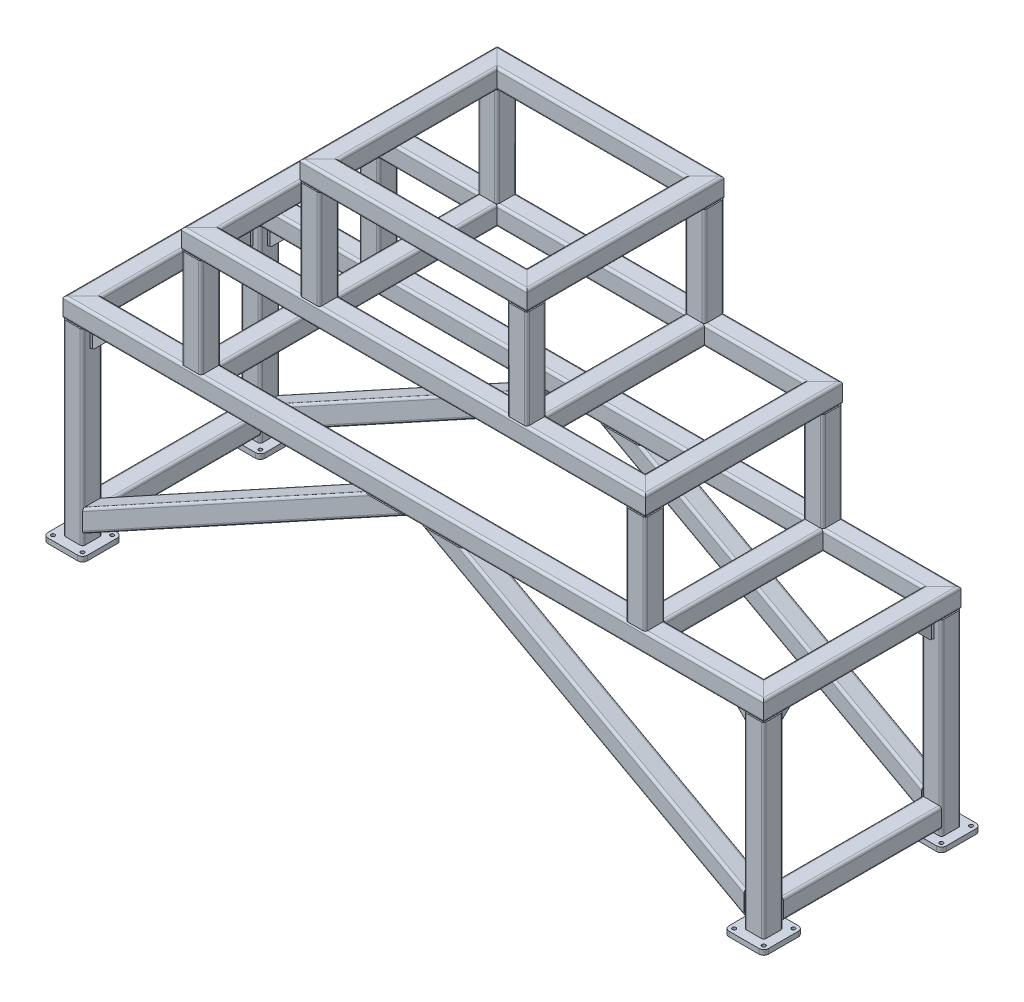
SolidWorks part; units mm, degrees
other "DetailItem1"
other "DetailItem2"
other "DetailItem3"
other "DetailItem4"
other "DetailItem5"
other "DetailItem6"
other "DetailItem7"
other "DetailItem8"
ref_plane "Front Plane" through (0, 0, 0) normal (0, 0, 1) x (1, 0, 0)
ref_plane "Top Plane" through (0, 0, 0) normal (0, 1, 0) x (1, 0, 0)
ref_plane "Right Plane" through (0, 0, 0) normal (1, 0, 0) x (0, 0, -1)
sketch3d "3DSketch1"
  line L0 (533.4, 0, 457.2) -> (533.4, -609.6, 457.2)
  line L1 (-533.4, 0, -457.2) -> (533.4, 0, -457.2)
  line L2 (-533.4, 0, -457.2) -> (-533.4, 0, 457.2)
  line L3 (-533.4, 0, 457.2) -> (533.4, 0, 457.2)
  line L4 (533.4, 0, -457.2) -> (533.4, 0, 457.2)
  line L5 (-533.4, 0, -457.2) -> (533.4, 0, 457.2) construction
  line L6 (-533.4, 0, 457.2) -> (533.4, 0, -457.2) construction
  line L7 (533.4, 0, -457.2) -> (533.4, -609.6, -457.2)
  line L8 (-533.4, 0, -457.2) -> (-533.4, -609.6, -457.2)
  line L9 (-533.4, 0, 457.2) -> (-533.4, -609.6, 457.2)
  line L10 (-533.4, -609.6, 457.2) -> (-533.4, -609.6, -457.2)
  line L11 (533.4, -609.6, 457.2) -> (533.4, -609.6, -457.2)
  line L12 (1752.6, -2150.4402, 457.2) -> (1752.6, -2150.4402, -457.2)
  line L13 (-1752.6, -2150.4402, -457.2) -> (-1752.6, -2150.4402, 457.2)
  line L16 (1143, -609.6, 457.2) -> (-1143, -609.6, 457.2)
  line L17 (1143, -609.6, -457.2) -> (-1143, -609.6, -457.2)
  line L18 (1143, -609.6, 457.2) -> (1143, -609.6, -457.2)
  line L19 (-1143, -609.6, 457.2) -> (-1143, -609.6, -457.2)
  line L20 (1143, -609.6, 457.2) -> (1143, -1219.2, 457.2)
  line L21 (1143, -609.6, -457.2) -> (1143, -1219.2, -457.2)
  line L22 (-1143, -609.6, 457.2) -> (-1143, -1219.2, 457.2)
  line L23 (-1143, -609.6, -457.2) -> (-1143, -1219.2, -457.2)
  line L24 (-1143, -1219.2, 457.2) -> (-1143, -1219.2, -457.2)
  line L25 (1143, -1219.2, 457.2) -> (1143, -1219.2, -457.2)
  line L26 (1752.6, -1219.2, 457.2) -> (-1752.6, -1219.2, 457.2)
  line L27 (1752.6, -1219.2, -457.2) -> (-1752.6, -1219.2, -457.2)
  line L32 (-1752.6, -1219.2, 457.2) -> (-1752.6, -1219.2, -457.2)
  line L33 (1752.6, -1219.2, 457.2) -> (1752.6, -1219.2, -457.2)
  line L34 (-1752.6, -1219.2, 457.2) -> (-1752.6, -2235.2, 457.2)
  line L35 (-1752.6, -1219.2, -457.2) -> (-1752.6, -2235.2, -457.2)
  line L36 (1752.6, -1219.2, 457.2) -> (1752.6, -2235.2, 457.2)
  line L37 (1752.6, -1219.2, -457.2) -> (1752.6, -2235.2, -457.2)
  line L46 (-1752.6, -2150.4402, 457.2) -> (-53.975, -1219.2, 457.2)
  line L47 (53.975, -1219.2, 457.2) -> (1752.6, -2150.4402, 457.2)
  line L48 (1752.6, -2150.4402, -457.2) -> (53.975, -1219.2, -457.2)
  line L49 (-53.975, -1219.2, -457.2) -> (-1752.6, -2150.4402, -457.2)
  point P0 (0, 0, 0)
  dimension "D1" = 1066.8
  dimension "D2" = 914.4
  dimension "D3" = 609.6
  dimension "D4" = 609.6
  dimension "D5" = 609.6
  dimension "D8" = 53.975
  dimension "D6" = 609.6
  dimension "D7" = 1016
  dimension "D9" = 53.975
  dimension "D10" = 53.975
  dimension "D11" = 53.975
  dimension "D12" = 914.4
  dimension "D13" = 914.4
  dimension "D14" = 3505.2
  dimension "D15" = 1752.6
  dimension "D16" = 84.7598
  dimension "D17" = 84.7598
  dimension "D18" = 84.7598
  dimension "D19" = 84.7598
other "Structural Member1"
ref_plane "Plane8" through (-533.4, 0, 457.2) normal (1, 0, 0) x (0, 0, -1)
sketch "Sketch1" plane through (-533.4, 0, 457.2) normal (1, 0, 0) x (0, 0, -1)
  line L0 (-38.1, -44.45) -> (38.1, -44.45)
  line L1 (-44.45, -38.1) -> (-44.45, 38.1)
  line L2 (38.1, 44.45) -> (-38.1, 44.45)
  line L3 (44.45, 38.1) -> (44.45, -38.1)
  line L4 (-38.1, -50.8) -> (38.1, -50.8)
  line L5 (-50.8, -38.1) -> (-50.8, 38.1)
  line L6 (38.1, 50.8) -> (-38.1, 50.8)
  line L7 (50.8, 38.1) -> (50.8, -38.1)
  line L8 (0, 0) -> (44.45, 0) construction
  line L9 (0, 0) -> (0, 44.45) construction
  arc A0 (50.8, 38.1) -> (38.1, 50.8) centre (38.1, 38.1) ccw
  arc A1 (38.1, -50.8) -> (50.8, -38.1) centre (38.1, -38.1) ccw
  arc A2 (-50.8, -38.1) -> (-38.1, -50.8) centre (-38.1, -38.1) ccw
  arc A3 (-38.1, 50.8) -> (-50.8, 38.1) centre (-38.1, 38.1) ccw
  arc A4 (-38.1, 44.45) -> (-44.45, 38.1) centre (-38.1, 38.1) ccw
  arc A5 (44.45, 38.1) -> (38.1, 44.45) centre (38.1, 38.1) ccw
  arc A6 (38.1, -44.45) -> (44.45, -38.1) centre (38.1, -38.1) ccw
  arc A7 (-44.45, -38.1) -> (-38.1, -44.45) centre (-38.1, -38.1) ccw
  point P3 (0, 50.8)
  point P4 (50.8, 0)
  point P5 (0, -50.8)
  point P6 (-50.8, 0)
  point P7 (-50.8, 50.8)
  point P8 (-50.8, -50.8)
  point P33 (0, 0)
  point P35 (50.8, -50.8)
  point P36 (50.8, 50.8)
  point P37 (0, 0)
  dimension "D1" = 12.7
  dimension "Thickness" = 6.35
  dimension "V_leg" = 101.6
other "Structural Member2"
ref_plane "Plane9" through (1143, -609.6, 457.2) normal (-1, 0, 0) x (0, 0, 1)
sketch "Sketch17" plane through (1143, -609.6, 457.2) normal (-1, 0, 0) x (0, 0, 1)
  line L0 (-38.1, -44.45) -> (38.1, -44.45)
  line L1 (-44.45, -38.1) -> (-44.45, 38.1)
  line L2 (38.1, 44.45) -> (-38.1, 44.45)
  line L3 (44.45, 38.1) -> (44.45, -38.1)
  line L4 (-38.1, -50.8) -> (38.1, -50.8)
  line L5 (-50.8, -38.1) -> (-50.8, 38.1)
  line L6 (38.1, 50.8) -> (-38.1, 50.8)
  line L7 (50.8, 38.1) -> (50.8, -38.1)
  line L8 (0, 0) -> (44.45, 0) construction
  line L9 (0, 0) -> (0, 44.45) construction
  arc A0 (50.8, 38.1) -> (38.1, 50.8) centre (38.1, 38.1) ccw
  arc A1 (38.1, -50.8) -> (50.8, -38.1) centre (38.1, -38.1) ccw
  arc A2 (-50.8, -38.1) -> (-38.1, -50.8) centre (-38.1, -38.1) ccw
  arc A3 (-38.1, 50.8) -> (-50.8, 38.1) centre (-38.1, 38.1) ccw
  arc A4 (-38.1, 44.45) -> (-44.45, 38.1) centre (-38.1, 38.1) ccw
  arc A5 (44.45, 38.1) -> (38.1, 44.45) centre (38.1, 38.1) ccw
  arc A6 (38.1, -44.45) -> (44.45, -38.1) centre (38.1, -38.1) ccw
  arc A7 (-44.45, -38.1) -> (-38.1, -44.45) centre (-38.1, -38.1) ccw
  point P3 (0, 50.8)
  point P4 (50.8, 0)
  point P5 (0, -50.8)
  point P6 (-50.8, 0)
  point P7 (-50.8, 50.8)
  point P8 (-50.8, -50.8)
  point P33 (0, 0)
  point P35 (50.8, -50.8)
  point P36 (50.8, 50.8)
  point P37 (0, 0)
  dimension "D1" = 12.7
  dimension "Thickness" = 6.35
  dimension "V_leg" = 101.6
other "Structural Member3"
ref_plane "Plane10" through (1752.6, -1219.2, 457.2) normal (-1, 0, 0) x (0, 0, 1)
sketch "Sketch18" plane through (1752.6, -1219.2, 457.2) normal (-1, 0, 0) x (0, 0, 1)
  line L0 (-38.1, -44.45) -> (38.1, -44.45)
  line L1 (-44.45, -38.1) -> (-44.45, 38.1)
  line L2 (38.1, 44.45) -> (-38.1, 44.45)
  line L3 (44.45, 38.1) -> (44.45, -38.1)
  line L4 (-38.1, -50.8) -> (38.1, -50.8)
  line L5 (-50.8, -38.1) -> (-50.8, 38.1)
  line L6 (38.1, 50.8) -> (-38.1, 50.8)
  line L7 (50.8, 38.1) -> (50.8, -38.1)
  line L8 (0, 0) -> (44.45, 0) construction
  line L9 (0, 0) -> (0, 44.45) construction
  arc A0 (50.8, 38.1) -> (38.1, 50.8) centre (38.1, 38.1) ccw
  arc A1 (38.1, -50.8) -> (50.8, -38.1) centre (38.1, -38.1) ccw
  arc A2 (-50.8, -38.1) -> (-38.1, -50.8) centre (-38.1, -38.1) ccw
  arc A3 (-38.1, 50.8) -> (-50.8, 38.1) centre (-38.1, 38.1) ccw
  arc A4 (-38.1, 44.45) -> (-44.45, 38.1) centre (-38.1, 38.1) ccw
  arc A5 (44.45, 38.1) -> (38.1, 44.45) centre (38.1, 38.1) ccw
  arc A6 (38.1, -44.45) -> (44.45, -38.1) centre (38.1, -38.1) ccw
  arc A7 (-44.45, -38.1) -> (-38.1, -44.45) centre (-38.1, -38.1) ccw
  point P3 (0, 50.8)
  point P4 (50.8, 0)
  point P5 (0, -50.8)
  point P6 (-50.8, 0)
  point P7 (-50.8, 50.8)
  point P8 (-50.8, -50.8)
  point P33 (0, 0)
  point P35 (50.8, -50.8)
  point P36 (50.8, 50.8)
  point P37 (0, 0)
  dimension "D1" = 12.7
  dimension "Thickness" = 6.35
  dimension "V_leg" = 101.6
other "Structural Member4"
ref_plane "Plane11" through (-533.4, 0, 457.2) normal (0, -1, 0) x (1, 0, 0)
sketch "Sketch19" plane through (-533.4, 0, 457.2) normal (0, -1, 0) x (1, 0, 0)
  line L0 (-38.1, -44.45) -> (38.1, -44.45)
  line L1 (-44.45, -38.1) -> (-44.45, 38.1)
  line L2 (38.1, 44.45) -> (-38.1, 44.45)
  line L3 (44.45, 38.1) -> (44.45, -38.1)
  line L4 (-38.1, -50.8) -> (38.1, -50.8)
  line L5 (-50.8, -38.1) -> (-50.8, 38.1)
  line L6 (38.1, 50.8) -> (-38.1, 50.8)
  line L7 (50.8, 38.1) -> (50.8, -38.1)
  line L8 (0, 0) -> (44.45, 0) construction
  line L9 (0, 0) -> (0, 44.45) construction
  arc A0 (50.8, 38.1) -> (38.1, 50.8) centre (38.1, 38.1) ccw
  arc A1 (38.1, -50.8) -> (50.8, -38.1) centre (38.1, -38.1) ccw
  arc A2 (-50.8, -38.1) -> (-38.1, -50.8) centre (-38.1, -38.1) ccw
  arc A3 (-38.1, 50.8) -> (-50.8, 38.1) centre (-38.1, 38.1) ccw
  arc A4 (-38.1, 44.45) -> (-44.45, 38.1) centre (-38.1, 38.1) ccw
  arc A5 (44.45, 38.1) -> (38.1, 44.45) centre (38.1, 38.1) ccw
  arc A6 (38.1, -44.45) -> (44.45, -38.1) centre (38.1, -38.1) ccw
  arc A7 (-44.45, -38.1) -> (-38.1, -44.45) centre (-38.1, -38.1) ccw
  point P3 (0, 50.8)
  point P4 (50.8, 0)
  point P5 (0, -50.8)
  point P6 (-50.8, 0)
  point P7 (-50.8, 50.8)
  point P8 (-50.8, -50.8)
  point P33 (0, 0)
  point P35 (50.8, -50.8)
  point P36 (50.8, 50.8)
  point P37 (0, 0)
  dimension "D1" = 12.7
  dimension "Thickness" = 6.35
  dimension "V_leg" = 101.6
other "Structural Member5"
ref_plane "Plane12" through (-533.4, -609.6, 457.2) normal (0, 0, -1) x (1, 0, 0)
sketch "Sketch110" plane through (-533.4, -609.6, 457.2) normal (0, 0, -1) x (1, 0, 0)
  line L0 (-38.1, -44.45) -> (38.1, -44.45)
  line L1 (-44.45, -38.1) -> (-44.45, 38.1)
  line L2 (38.1, 44.45) -> (-38.1, 44.45)
  line L3 (44.45, 38.1) -> (44.45, -38.1)
  line L4 (-38.1, -50.8) -> (38.1, -50.8)
  line L5 (-50.8, -38.1) -> (-50.8, 38.1)
  line L6 (38.1, 50.8) -> (-38.1, 50.8)
  line L7 (50.8, 38.1) -> (50.8, -38.1)
  line L8 (0, 0) -> (44.45, 0) construction
  line L9 (0, 0) -> (0, 44.45) construction
  arc A0 (50.8, 38.1) -> (38.1, 50.8) centre (38.1, 38.1) ccw
  arc A1 (38.1, -50.8) -> (50.8, -38.1) centre (38.1, -38.1) ccw
  arc A2 (-50.8, -38.1) -> (-38.1, -50.8) centre (-38.1, -38.1) ccw
  arc A3 (-38.1, 50.8) -> (-50.8, 38.1) centre (-38.1, 38.1) ccw
  arc A4 (-38.1, 44.45) -> (-44.45, 38.1) centre (-38.1, 38.1) ccw
  arc A5 (44.45, 38.1) -> (38.1, 44.45) centre (38.1, 38.1) ccw
  arc A6 (38.1, -44.45) -> (44.45, -38.1) centre (38.1, -38.1) ccw
  arc A7 (-44.45, -38.1) -> (-38.1, -44.45) centre (-38.1, -38.1) ccw
  point P3 (0, 50.8)
  point P4 (50.8, 0)
  point P5 (0, -50.8)
  point P6 (-50.8, 0)
  point P7 (-50.8, 50.8)
  point P8 (-50.8, -50.8)
  point P33 (0, 0)
  point P35 (50.8, -50.8)
  point P36 (50.8, 50.8)
  point P37 (0, 0)
  dimension "D1" = 12.7
  dimension "Thickness" = 6.35
  dimension "V_leg" = 101.6
other "Structural Member6"
ref_plane "Plane13" through (-1752.6, -2150.4402, 457.2) normal (0.8769, 0.4807, 0) x (0.1894, -0.3454, -0.9191)
sketch "Sketch111" plane through (-1752.6, -2150.4402, 457.2) normal (0.8769, 0.4807, 0) x (0.1894, -0.3454, -0.9191)
  line L0 (-38.1, -44.45) -> (38.1, -44.45)
  line L1 (-44.45, -38.1) -> (-44.45, 38.1)
  line L2 (38.1, 44.45) -> (-38.1, 44.45)
  line L3 (44.45, 38.1) -> (44.45, -38.1)
  line L4 (-38.1, -50.8) -> (38.1, -50.8)
  line L5 (-50.8, -38.1) -> (-50.8, 38.1)
  line L6 (38.1, 50.8) -> (-38.1, 50.8)
  line L7 (50.8, 38.1) -> (50.8, -38.1)
  line L8 (0, 0) -> (44.45, 0) construction
  line L9 (0, 0) -> (0, 44.45) construction
  arc A0 (50.8, 38.1) -> (38.1, 50.8) centre (38.1, 38.1) ccw
  arc A1 (38.1, -50.8) -> (50.8, -38.1) centre (38.1, -38.1) ccw
  arc A2 (-50.8, -38.1) -> (-38.1, -50.8) centre (-38.1, -38.1) ccw
  arc A3 (-38.1, 50.8) -> (-50.8, 38.1) centre (-38.1, 38.1) ccw
  arc A4 (-38.1, 44.45) -> (-44.45, 38.1) centre (-38.1, 38.1) ccw
  arc A5 (44.45, 38.1) -> (38.1, 44.45) centre (38.1, 38.1) ccw
  arc A6 (38.1, -44.45) -> (44.45, -38.1) centre (38.1, -38.1) ccw
  arc A7 (-44.45, -38.1) -> (-38.1, -44.45) centre (-38.1, -38.1) ccw
  point P3 (0, 50.8)
  point P4 (50.8, 0)
  point P5 (0, -50.8)
  point P6 (-50.8, 0)
  point P7 (-50.8, 50.8)
  point P8 (-50.8, -50.8)
  point P33 (0, 0)
  point P35 (50.8, -50.8)
  point P36 (50.8, 50.8)
  point P37 (0, 0)
  dimension "D1" = 12.7
  dimension "Thickness" = 6.35
  dimension "V_leg" = 101.6
other "Structural Member7"
ref_plane "Plane14" through (53.975, -1219.2, 457.2) normal (0.8769, -0.4807, 0) x (0.1894, 0.3454, -0.9191)
sketch "Sketch112" plane through (53.975, -1219.2, 457.2) normal (0.8769, -0.4807, 0) x (0.1894, 0.3454, -0.9191)
  line L0 (-38.1, -44.45) -> (38.1, -44.45)
  line L1 (-44.45, -38.1) -> (-44.45, 38.1)
  line L2 (38.1, 44.45) -> (-38.1, 44.45)
  line L3 (44.45, 38.1) -> (44.45, -38.1)
  line L4 (-38.1, -50.8) -> (38.1, -50.8)
  line L5 (-50.8, -38.1) -> (-50.8, 38.1)
  line L6 (38.1, 50.8) -> (-38.1, 50.8)
  line L7 (50.8, 38.1) -> (50.8, -38.1)
  line L8 (0, 0) -> (44.45, 0) construction
  line L9 (0, 0) -> (0, 44.45) construction
  arc A0 (50.8, 38.1) -> (38.1, 50.8) centre (38.1, 38.1) ccw
  arc A1 (38.1, -50.8) -> (50.8, -38.1) centre (38.1, -38.1) ccw
  arc A2 (-50.8, -38.1) -> (-38.1, -50.8) centre (-38.1, -38.1) ccw
  arc A3 (-38.1, 50.8) -> (-50.8, 38.1) centre (-38.1, 38.1) ccw
  arc A4 (-38.1, 44.45) -> (-44.45, 38.1) centre (-38.1, 38.1) ccw
  arc A5 (44.45, 38.1) -> (38.1, 44.45) centre (38.1, 38.1) ccw
  arc A6 (38.1, -44.45) -> (44.45, -38.1) centre (38.1, -38.1) ccw
  arc A7 (-44.45, -38.1) -> (-38.1, -44.45) centre (-38.1, -38.1) ccw
  point P3 (0, 50.8)
  point P4 (50.8, 0)
  point P5 (0, -50.8)
  point P6 (-50.8, 0)
  point P7 (-50.8, 50.8)
  point P8 (-50.8, -50.8)
  point P33 (0, 0)
  point P35 (50.8, -50.8)
  point P36 (50.8, 50.8)
  point P37 (0, 0)
  dimension "D1" = 12.7
  dimension "Thickness" = 6.35
  dimension "V_leg" = 101.6
other "Trim/Extend1"
other "Trim/Extend2"
other "Trim/Extend3"
other "Trim/Extend4"
other "Trim/Extend5"
other "Trim/Extend6"
other "Trim/Extend7"
sketch "Sketch113" plane through (0, -2235.2, 0) normal (0, -1, 0) x (1, 0, 0)
  line L0 (0, 0) -> (0, -664.0732) construction
  line L1 (-533.4, 457.2) -> (533.4, -457.2) construction
  line L2 (-1651, -558.8) -> (-1854.2, -355.6) construction
  line L3 (-1651, -355.6) -> (-1854.2, -558.8) construction
  line L4 (-1651, 355.6) -> (-1854.2, 558.8) construction
  line L5 (-1651, 558.8) -> (-1854.2, 355.6) construction
  line L6 (-1854.2, -381) -> (-1854.2, -533.4)
  line L7 (-1676.4, -558.8) -> (-1828.8, -558.8)
  line L8 (1676.4, -355.6) -> (1828.8, -355.6)
  line L9 (1676.4, 558.8) -> (1828.8, 558.8)
  line L10 (1651, 533.4) -> (1651, 381)
  line L11 (1676.4, 355.6) -> (1828.8, 355.6)
  line L12 (1854.2, 533.4) -> (1854.2, 381)
  line L13 (1651, 558.8) -> (1854.2, 355.6) construction
  line L14 (1651, 355.6) -> (1854.2, 558.8) construction
  line L15 (1651, -381) -> (1651, -533.4)
  line L16 (-1651, -381) -> (-1651, -533.4)
  line L17 (-1854.2, 533.4) -> (-1854.2, 381)
  line L18 (-1676.4, 355.6) -> (-1828.8, 355.6)
  line L19 (-1651, 533.4) -> (-1651, 381)
  line L20 (1676.4, -558.8) -> (1828.8, -558.8)
  line L21 (1854.2, -381) -> (1854.2, -533.4)
  line L22 (1651, -355.6) -> (1854.2, -558.8) construction
  line L23 (1651, -558.8) -> (1854.2, -355.6) construction
  line L24 (-1676.4, 558.8) -> (-1828.8, 558.8)
  line L25 (-1676.4, -355.6) -> (-1828.8, -355.6)
  circle A0 centre (-1828.8, -533.4) radius 9.525
  circle A1 centre (-1676.4, -533.4) radius 9.525
  circle A2 centre (-1676.4, -381) radius 9.525
  circle A3 centre (-1828.8, -381) radius 9.525
  arc A4 (-1676.4, -355.6) -> (-1651, -381) centre (-1676.4, -381) cw
  arc A5 (-1651, -533.4) -> (-1676.4, -558.8) centre (-1676.4, -533.4) cw
  arc A6 (-1828.8, -558.8) -> (-1854.2, -533.4) centre (-1828.8, -533.4) cw
  arc A7 (-1828.8, -355.6) -> (-1854.2, -381) centre (-1828.8, -381) ccw
  arc A8 (1828.8, 558.8) -> (1854.2, 533.4) centre (1828.8, 533.4) cw
  arc A9 (1828.8, 355.6) -> (1854.2, 381) centre (1828.8, 381) ccw
  arc A10 (1651, 381) -> (1676.4, 355.6) centre (1676.4, 381) ccw
  arc A11 (1676.4, 558.8) -> (1651, 533.4) centre (1676.4, 533.4) ccw
  circle A12 centre (1828.8, 533.4) radius 9.525
  circle A13 centre (1676.4, 533.4) radius 9.525
  circle A14 centre (1676.4, 381) radius 9.525
  circle A15 centre (1828.8, 381) radius 9.525
  circle A16 centre (-1828.8, 381) radius 9.525
  circle A17 centre (-1676.4, 381) radius 9.525
  circle A18 centre (-1676.4, 533.4) radius 9.525
  circle A19 centre (-1828.8, 533.4) radius 9.525
  arc A20 (1828.8, -355.6) -> (1854.2, -381) centre (1828.8, -381) cw
  arc A21 (1828.8, -558.8) -> (1854.2, -533.4) centre (1828.8, -533.4) ccw
  arc A22 (1651, -533.4) -> (1676.4, -558.8) centre (1676.4, -533.4) ccw
  arc A23 (1676.4, -355.6) -> (1651, -381) centre (1676.4, -381) ccw
  circle A24 centre (1828.8, -381) radius 9.525
  circle A25 centre (1676.4, -381) radius 9.525
  circle A26 centre (1676.4, -533.4) radius 9.525
  circle A27 centre (1828.8, -533.4) radius 9.525
  arc A28 (-1676.4, 558.8) -> (-1651, 533.4) centre (-1676.4, 533.4) cw
  arc A29 (-1651, 381) -> (-1676.4, 355.6) centre (-1676.4, 381) cw
  arc A30 (-1828.8, 355.6) -> (-1854.2, 381) centre (-1828.8, 381) cw
  arc A31 (-1828.8, 558.8) -> (-1854.2, 533.4) centre (-1828.8, 533.4) ccw
  point P0 (1752.6, 457.2)
  point P22 (1752.6, -457.2)
  point P88 (-1752.6, -457.2)
  point P89 (-1752.6, 457.2)
  dimension "D3" = 25.4
  dimension "D4" = 19.05
  dimension "D7" = 25.4
  dimension "D8" = 19.05
  dimension "D1" = 203.2
  dimension "D2" = 203.2
  dimension "D5" = 203.2
  dimension "D6" = 203.2
extrude "Foot Pads" add sketch "Sketch113" along normal blind 25.4 separate body
other "Gusset1" parameters "D1"=12.7, "D2"=6.35, "D3"=0, "D4"=0, "D10"=6.35, "D11"=101.6, "D12"=101.6, "D13"=12.7, "D14"=45, "D15"=12.7, "D16"=50.8, "D17"=50.8, "D18"=45
sketch "Sketch114" plane through (1752.6, -1270, -406.4) normal (-1, 0, 0) x (0, 0, 1)
  line L0 (0, 0) -> (101.6, 0)
  line L1 (0, 0) -> (0, -101.6)
  line L2 (101.6, -12.7) -> (12.7, -101.6)
  line L3 (101.6, 0) -> (101.6, -12.7)
  line L4 (0, -101.6) -> (12.7, -101.6)
other "Gusset2" parameters "D1"=12.7, "D2"=12.7, "D3"=0, "D4"=0, "D10"=6.35, "D11"=101.6, "D12"=101.6, "D13"=12.7, "D14"=45, "D15"=12.7, "D16"=50.8, "D17"=50.8, "D18"=45
sketch "Sketch115" plane through (1752.6, -1270, 406.4) normal (1, 0, 0) x (0, 0, -1)
  line L0 (0, 0) -> (101.6, 0)
  line L1 (0, 0) -> (0, -101.6)
  line L2 (101.6, -12.7) -> (12.7, -101.6)
  line L3 (101.6, 0) -> (101.6, -12.7)
  line L4 (0, -101.6) -> (12.7, -101.6)
other "Gusset3" parameters "D1"=12.7, "D2"=12.7, "D3"=0, "D4"=0, "D10"=6.35, "D11"=101.6, "D12"=101.6, "D13"=12.7, "D14"=45, "D15"=12.7
sketch "Sketch116" plane through (-1752.6, -1270, -406.4) normal (-1, 0, 0) x (0, 0, 1)
  line L0 (0, 0) -> (0, -101.6)
  line L1 (0, 0) -> (101.6, 0)
  line L2 (12.7, -101.6) -> (101.6, -12.7)
  line L3 (0, -101.6) -> (12.7, -101.6)
  line L4 (101.6, 0) -> (101.6, -12.7)
other "Gusset4" parameters "D1"=12.7, "D2"=12.7, "D3"=0, "D4"=0, "D10"=6.35, "D11"=101.6, "D12"=101.6, "D13"=12.7, "D14"=45, "D15"=12.7
sketch "Sketch117" plane through (-1752.6, -1270, 406.4) normal (1, 0, 0) x (0, 0, -1)
  line L0 (0, 0) -> (101.6, 0)
  line L1 (0, 0) -> (0, -101.6)
  line L2 (101.6, -12.7) -> (12.7, -101.6)
  line L3 (101.6, 0) -> (101.6, -12.7)
  line L4 (0, -101.6) -> (12.7, -101.6)
other "Gusset5" parameters "D1"=12.7, "D2"=12.7, "D3"=0, "D4"=0, "D10"=6.35, "D11"=101.6, "D12"=101.6, "D13"=12.7, "D14"=45, "D15"=12.7
sketch "Sketch118" plane through (1701.8, -1270, 457.2) normal (0, 0, -1) x (-1, 0, 0)
  line L0 (0, 0) -> (0, -101.6)
  line L1 (0, 0) -> (101.6, 0)
  line L2 (12.7, -101.6) -> (101.6, -12.7)
  line L3 (0, -101.6) -> (12.7, -101.6)
  line L4 (101.6, 0) -> (101.6, -12.7)
other "Gusset6" parameters "D1"=12.7, "D2"=12.7, "D3"=0, "D4"=0, "D10"=6.35, "D11"=101.6, "D12"=101.6, "D13"=12.7, "D14"=45, "D15"=12.7
sketch "Sketch119" plane through (-1701.8, -1270, 457.2) normal (0, 0, 1) x (1, 0, 0)
  line L0 (0, 0) -> (0, -101.6)
  line L1 (0, 0) -> (101.6, 0)
  line L2 (12.7, -101.6) -> (101.6, -12.7)
  line L3 (0, -101.6) -> (12.7, -101.6)
  line L4 (101.6, 0) -> (101.6, -12.7)
other "Gusset7" parameters "D1"=12.7, "D2"=12.7, "D3"=0, "D4"=0, "D10"=6.35, "D11"=101.6, "D12"=101.6, "D13"=12.7, "D14"=45, "D15"=12.7
sketch "Sketch120" plane through (-1701.8, -1270, -457.2) normal (0, 0, 1) x (1, 0, 0)
  line L0 (0, 0) -> (0, -101.6)
  line L1 (0, 0) -> (101.6, 0)
  line L2 (12.7, -101.6) -> (101.6, -12.7)
  line L3 (0, -101.6) -> (12.7, -101.6)
  line L4 (101.6, 0) -> (101.6, -12.7)
other "Gusset8" parameters "D1"=12.7, "D2"=12.7, "D3"=0, "D4"=0, "D10"=6.35, "D11"=101.6, "D12"=101.6, "D13"=12.7, "D14"=45, "D15"=12.7
sketch "Sketch121" plane through (1701.8, -1270, -457.2) normal (0, 0, -1) x (-1, 0, 0)
  line L0 (0, 0) -> (0, -101.6)
  line L1 (0, 0) -> (101.6, 0)
  line L2 (12.7, -101.6) -> (101.6, -12.7)
  line L3 (0, -101.6) -> (12.7, -101.6)
  line L4 (101.6, 0) -> (101.6, -12.7)
other "Fillet Bead1" parameters "D10"=6.35, "D11"=6.35, "D12"=6.35, "D13"=3.175, "D14"=3.175
other "Fillet Bead2" parameters "D10"=6.35, "D11"=6.35, "D12"=6.35, "D13"=3.175, "D14"=3.175
other "Fillet Bead3" parameters "D10"=6.35, "D11"=6.35, "D12"=6.35, "D13"=3.175, "D14"=3.175
other "Fillet Bead4" parameters "D10"=6.35, "D11"=6.35, "D12"=6.35, "D13"=3.175, "D14"=3.175
other "Fillet Bead5" parameters "D10"=6.35, "D11"=6.35, "D12"=6.35, "D13"=3.175, "D14"=3.175
other "Fillet Bead6" parameters "D10"=6.35, "D11"=6.35, "D12"=6.35, "D13"=3.175, "D14"=3.175
other "Fillet Bead7" parameters "D10"=6.35, "D11"=6.35, "D12"=6.35, "D13"=3.175, "D14"=3.175
other "Fillet Bead8" parameters "D10"=6.35, "D11"=6.35, "D12"=6.35, "D13"=3.175, "D14"=3.175
